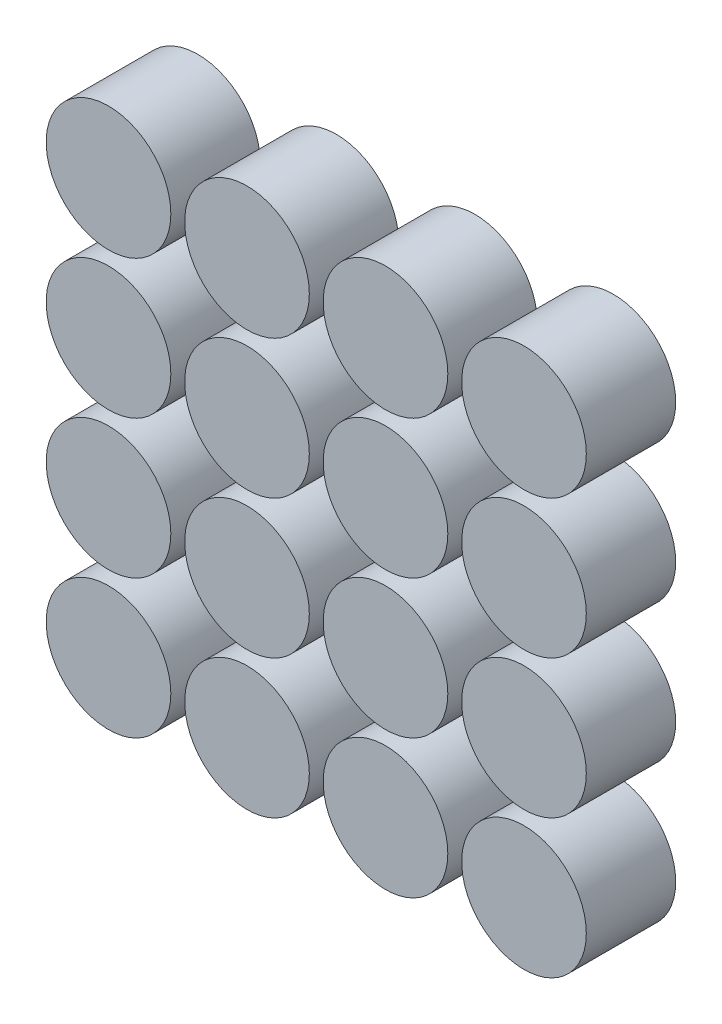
SolidWorks part; units mm, degrees
ref_plane "前视基准面" through (0, 0, 0) normal (0, 0, 1) x (1, 0, 0)
ref_plane "上视基准面" through (0, 0, 0) normal (0, 1, 0) x (1, 0, 0)
ref_plane "右视基准面" through (0, 0, 0) normal (1, 0, 0) x (0, 0, -1)
other "Configuration Table"
sketch "草图1" plane through (0, 0, 0) normal (0, 0, 1) x (1, 0, 0)
  circle A0 centre (-16.5, -16.5) radius 4.95
  circle A1 centre (-5.5, -16.5) radius 4.95
  circle A2 centre (5.5, -16.5) radius 4.95
  circle A3 centre (16.5, -16.5) radius 4.95
  circle A4 centre (-16.5, -5.5) radius 4.95
  circle A5 centre (-5.5, -5.5) radius 4.95
  circle A6 centre (5.5, -5.5) radius 4.95
  circle A7 centre (16.5, -5.5) radius 4.95
  circle A8 centre (-16.5, 5.5) radius 4.95
  circle A9 centre (-5.5, 5.5) radius 4.95
  circle A10 centre (5.5, 5.5) radius 4.95
  circle A11 centre (16.5, 5.5) radius 4.95
  circle A12 centre (-16.5, 16.5) radius 4.95
  circle A13 centre (-5.5, 16.5) radius 4.95
  circle A14 centre (5.5, 16.5) radius 4.95
  circle A15 centre (16.5, 16.5) radius 4.95
  dimension "D1" = 9.9
  dimension "D2" = 5.5
  dimension "D3" = 16.5
  dimension "D4" = 5.5
  dimension "D5" = 16.5
  dimension "D6" = 5.5
  dimension "D7" = 16.5
  dimension "D8" = 5.5
  dimension "D9" = 16.5
extrude "Sixteen_nominal_bodies" add sketch "草图1" along normal blind 7.1 separate body
